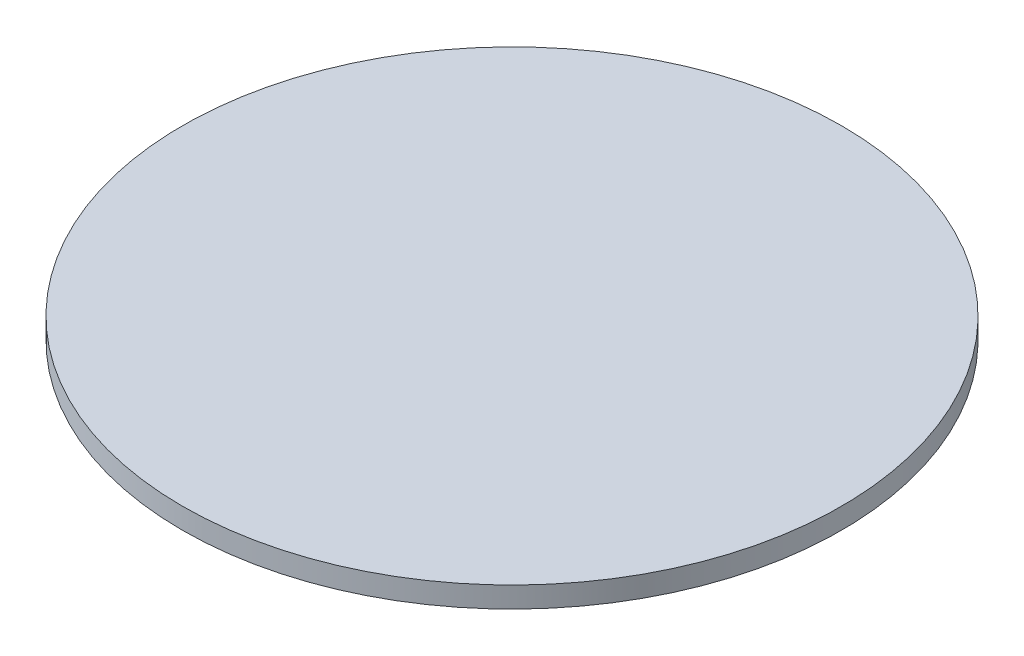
SolidWorks part; units mm, degrees
ref_plane "Front Plane" through (0, 0, 0) normal (0, 0, 1) x (1, 0, 0)
ref_plane "Top Plane" through (0, 0, 0) normal (0, 1, 0) x (1, 0, 0)
ref_plane "Right Plane" through (0, 0, 0) normal (1, 0, 0) x (0, 0, -1)
sketch "Sketch1" plane through (0, 0, 0) normal (0, 1, 0) x (1, 0, 0)
  circle A0 centre (0, 0) radius 100.33
  dimension "D1" = 200.66
extrude "Boss-Extrude1" add sketch "Sketch1" along normal blind 6.35
